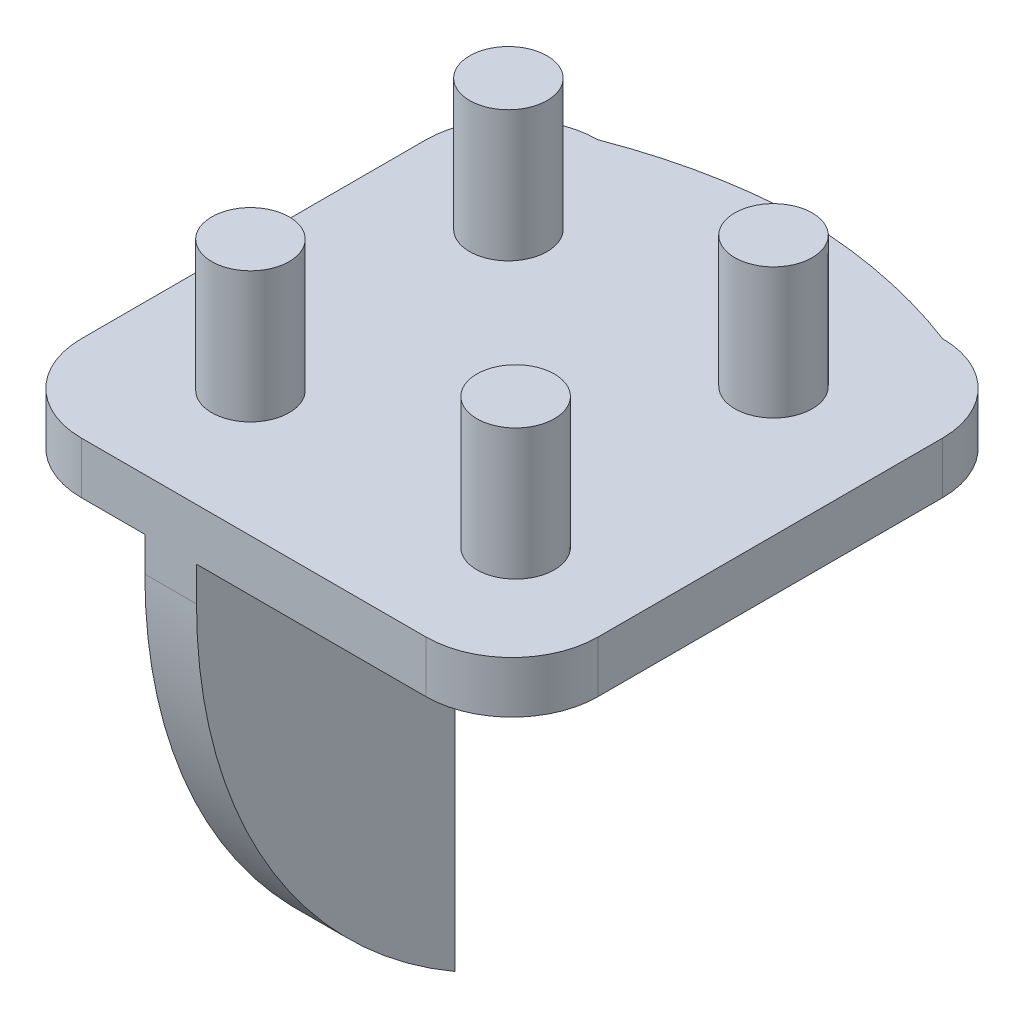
SolidWorks part; units mm, degrees
ref_plane "Plan de face" through (0, 0, 0) normal (0, 0, 1) x (1, 0, 0)
ref_plane "Plan de dessus" through (0, 0, 0) normal (0, 1, 0) x (1, 0, 0)
ref_plane "Plan de droite" through (0, 0, 0) normal (1, 0, 0) x (0, 0, -1)
sketch "Esquisse1" plane through (0, 0, 0) normal (0, 1, 0) x (1, 0, 0)
  line L1 (10, 15) -> (-10, 15)
  line L2 (15, 10) -> (15, -10)
  line L3 (10, -15) -> (-10, -15)
  line L4 (-15, 10) -> (-15, -10)
  line L5 (15, 15) -> (-15, -15) construction
  line L6 (15, -15) -> (-15, 15) construction
  line L11 (8.1059, -7.8963) -> (-8.1052, 7.8956) construction
  line L12 (7.4935, 7.6917) -> (-7.4941, -7.6924) construction
  circle A0 centre (-8.1052, 7.8956) radius 2.25
  circle A1 centre (7.4935, 7.6917) radius 2.25
  circle A2 centre (8.1059, -7.8963) radius 2.25
  circle A3 centre (-7.4941, -7.6924) radius 2.25
  arc A4 (10, 15) -> (15, 10) centre (10, 10) cw
  arc A5 (15, -10) -> (10, -15) centre (10, -10) cw
  arc A6 (-10, -15) -> (-15, -10) centre (-10, -10) cw
  arc A7 (-15, 10) -> (-10, 15) centre (-10, 10) cw
  point P0 (0, 0)
  point P6 (0, 0)
  dimension "D5" = 4.5
  dimension "D6" = 4.5
  dimension "D7" = 4.5
  dimension "D8" = 4.5
  dimension "D9" = 5
  dimension "D1" = 30
  dimension "D2" = 30
  dimension "D3" = 15.6
  dimension "D4" = 15.6
  dimension "D10" = 15.6
  dimension "D11" = 15.6
extrude "Boss.-Extru.3" add sketch "Esquisse1" along normal blind 7.6 contours A0 | A1 | A2 | A3
sketch "Esquisse2" plane through (0, 0, 0) normal (0, 1, 0) x (1, 0, 0)
  line L1 (10, 15) -> (-10, 15)
  line L2 (15, 10) -> (15, -10)
  line L3 (10, -15) -> (-10, -15)
  line L4 (-15, 10) -> (-15, -10)
  line L5 (15, 15) -> (-15, -15) construction
  line L6 (15, -15) -> (-15, 15) construction
  line L11 (7.6997, -7.699) -> (-7.699, 7.6984) construction
  line L12 (7.4997, 7.4997) -> (-7.5003, -7.5003) construction
  arc A4 (10, 15) -> (15, 10) centre (10, 10) cw
  arc A5 (15, -10) -> (10, -15) centre (10, -10) cw
  arc A6 (-10, -15) -> (-15, -10) centre (-10, -10) cw
  arc A7 (-15, 10) -> (-10, 15) centre (-10, 10) cw
  point P0 (0, 0)
  point P6 (0, 0)
  dimension "D9" = 5
  dimension "D1" = 30
  dimension "D2" = 30
  dimension "D4" = 15.2
extrude "Boss.-Extru.4" add sketch "Esquisse2" against normal blind 3
sketch "Esquisse5" plane through (0, -3, 0) normal (0, -1, 0) x (-1, 0, 0)
  line L0 (-10, 15) -> (10, 15) construction
  line L1 (6.3191, 15) -> (3.3191, 15)
  line L2 (6.3191, 15) -> (6.3191, -15)
  line L3 (6.3191, -15) -> (3.3191, -15)
  line L4 (3.3191, 15) -> (3.3191, -15)
  line L5 (10, -15) -> (-10, -15) construction
  dimension "D1" = 3
extrude "Boss.-Extru.7" add sketch "Esquisse5" along normal blind 2
sketch "Esquisse8" plane through (-3.3191, 0, 0) normal (1, 0, 0) x (0, 0, -1)
  line L1 (15, -5) -> (-15, -5)
  line L6 (15, -5) -> (15, -35)
  arc A2 (-15, -5) -> (15, -35) centre (15, -5) ccw
extrude "Boss.-Extru.9" add sketch "Esquisse8" against normal blind 3
sketch "Esquisse10" plane through (-3.3191, 0, 0) normal (1, 0, 0) x (0, 0, -1)
  line L0 (15, -35) -> (15, -3) construction
  line L1 (15, -13) -> (0, -13)
  line L2 (15, -13) -> (15, -48)
  line L3 (15, -48) -> (0, -48)
  line L4 (0, -13) -> (0, -48)
  line L5 (15, -3) -> (-15, -3) construction
  dimension "D1" = 10
  dimension "D2" = 15
  dimension "D3" = 35
extrude "Enlèv. mat.-Extru.3" cut sketch "Esquisse10" against normal blind 3
sketch "Esquisse11" plane through (-3.3191, 0, 0) normal (1, 0, 0) x (0, 0, -1)
  line L0 (15, -13) -> (15, -3) construction
  line L1 (15, -3) -> (-15, -3) construction
  circle A0 centre (11, -8) radius 2
  dimension "D1" = 4
  dimension "D2" = 4
  dimension "D3" = 5
extrude "Enlèv. mat.-Extru.4" cut sketch "Esquisse11" against normal through all
sketch "Esquisse12" plane through (0, -3, 0) normal (0, -1, 0) x (1, 0, 0)
  line L0 (10, -15) -> (-3.3191, -15) construction
  line L1 (1.1809, -15) -> (5.1809, -15)
  line L2 (1.1809, -15) -> (1.1809, -5)
  line L3 (1.1809, -5) -> (5.1809, -5)
  line L4 (5.1809, -15) -> (5.1809, -5)
  line L5 (-3.3191, -15) -> (-3.3191, 15) construction
  dimension "D1" = 4.5
  dimension "D2" = 10
  dimension "D3" = 4
extrude "Boss.-Extru.10" add sketch "Esquisse12" along normal blind 9.5
sketch "Esquisse13" plane through (5.1809, 0, 0) normal (1, 0, 0) x (0, 0, -1)
  line L0 (15, -12.5) -> (15, -3) construction
  line L1 (15, -3) -> (5, -3) construction
  line L3 (11, -3.9585) -> (7.5, -5.9793)
  line L4 (7.5, -5.9793) -> (7.5, -10.0207)
  line L5 (7.5, -10.0207) -> (11, -12.0415)
  line L6 (11, -12.0415) -> (14.5, -10.0207)
  line L7 (14.5, -10.0207) -> (14.5, -5.9793)
  line L8 (14.5, -5.9793) -> (11, -3.9585)
  circle A1 centre (11, -8) radius 3.5 construction
  dimension "D2" = 4
  dimension "D3" = 5
  dimension "D4" = 7
extrude "Enlèv. mat.-Extru.5" cut sketch "Esquisse13" against normal blind 3
sketch "Esquisse19" plane through (1.1809, 0, 0) normal (-1, 0, 0) x (0, 0, 1)
  line L0 (-15, -12.5) -> (-15, -3) construction
  line L1 (-5, -3) -> (-15, -3) construction
  circle A0 centre (-11, -8) radius 2
  dimension "D1" = 4
  dimension "D2" = 4
  dimension "D3" = 5
extrude "Enlèv. mat.-Extru.6" cut sketch "Esquisse19" against normal blind 3
sketch "Esquisse20" plane through (-6.3191, 0, 0) normal (-1, 0, 0) x (0, 0, 1)
  circle A0 centre (-11, -8) radius 3.5
  dimension "D1" = 7
extrude "Enlèv. mat.-Extru.7" cut sketch "Esquisse20" against normal blind 1.5
fillet "Congé2" radius 3 1 edges at (3.1809, -12.5, -5)
sketch "Esquisse23" plane through (0, 0, -15) normal (0, 0, -1) x (-1, 0, 0)
  line L0 (10, 0) -> (-10, 0)
  line L1 (-10, 0) -> (-10, -3)
  line L2 (-10, -3) -> (-5.1809, -3)
  line L3 (-5.1809, -3) -> (-5.1809, -12.5)
  line L4 (-5.1809, -12.5) -> (-1.1809, -12.5)
  line L5 (-1.1809, -12.5) -> (-1.1809, -3)
  line L6 (-1.1809, -3) -> (3.3191, -3)
  line L7 (3.3191, -3) -> (3.3191, -13)
  line L8 (3.3191, -13) -> (6.3191, -13)
  line L9 (6.3191, -13) -> (6.3191, -3)
  line L10 (6.3191, -3) -> (10, -3)
  line L11 (10, -3) -> (10, 0)
extrude "Boss.-Extru.11" add sketch "Esquisse23" along normal blind 2
fillet "Congé4" radius 30 2 edges at (-10, -1.5, -17) (10, -1.5, -17)
fillet "Congé5" radius 4 2 edges at (3.1899, -12.5, -16.7375) (-4.8263, -13, -16.4733)
